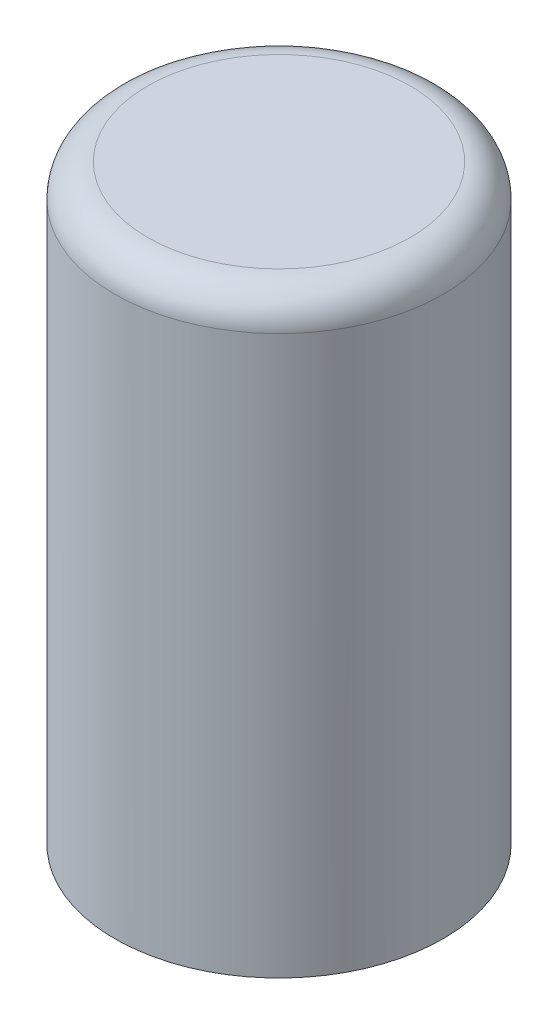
SolidWorks part; units mm, degrees
ref_plane "Front" through (0, 0, 0) normal (0, 0, 1) x (1, 0, 0)
ref_plane "Top" through (0, 0, 0) normal (0, 1, 0) x (1, 0, 0)
ref_plane "Right" through (0, 0, 0) normal (1, 0, 0) x (0, 0, -1)
sketch "Sketch1" plane through (0, 0, 0) normal (1, 0, 0) x (0, 0, -1)
  line L0 (0, 0) -> (0, 13.6787) construction
  line L1 (0, 13.2302) -> (0, 4.1447)
  line L2 (0, 13.2302) -> (3.175, 13.2302)
  line L5 (3.175, 13.2302) -> (3.175, 1.8002)
  line L6 (0, 4.1447) -> (2.794, 1.8002)
  line L7 (3.175, 1.8002) -> (2.794, 1.8002)
  circle A0 centre (0, 0) radius 3.175 construction
  dimension "D1" = 6.35
  dimension "D2" = 6.35
  dimension "D3" = 11.43
  dimension "D6" = 50
  dimension "D7" = 5.588
revolve "Revolve1" add sketch "Sketch1" angle 360 about L0
fillet "Fillet1" radius 0.635 1 edges at (0, 13.2302, -3.175)
